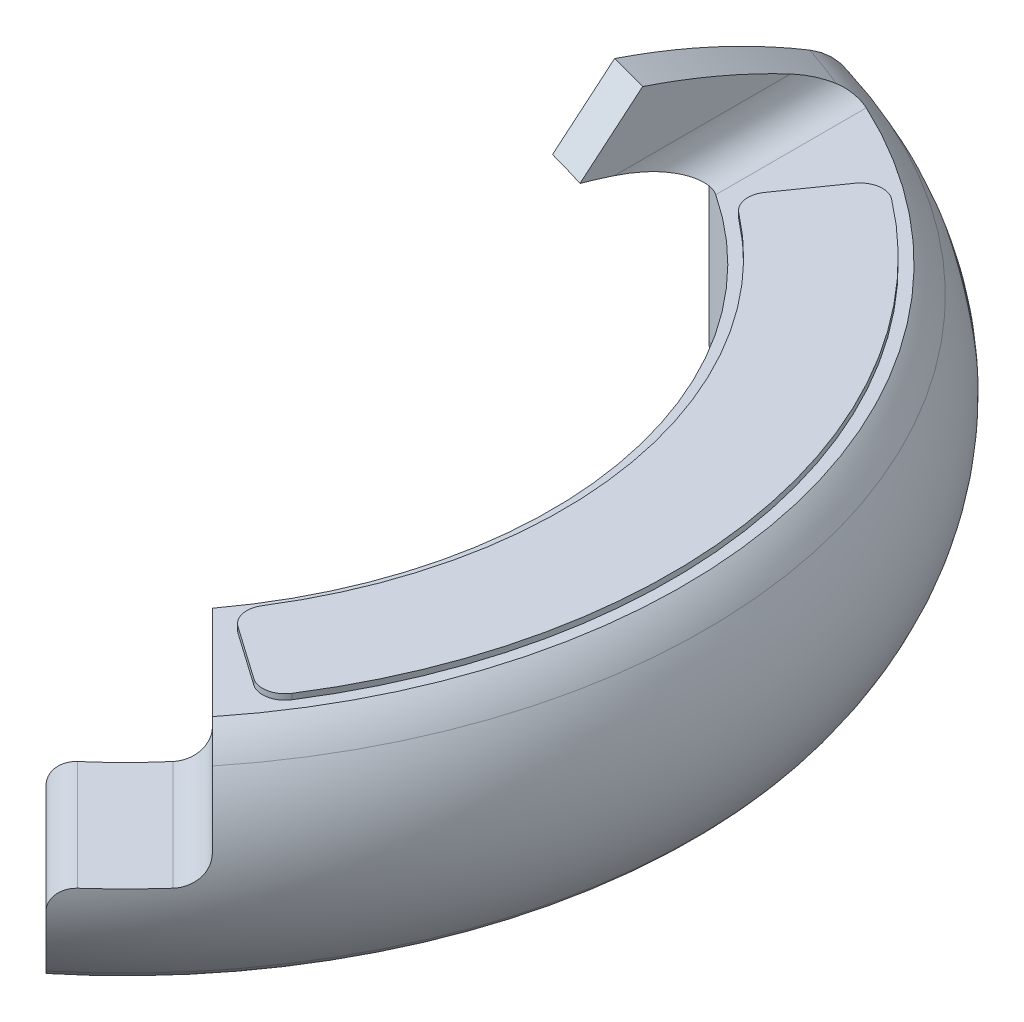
SolidWorks part; units mm, degrees
ref_plane "Спереди" through (0, 0, 0) normal (0, 0, 1) x (1, 0, 0)
ref_plane "Сверху" through (0, 0, 0) normal (0, 1, 0) x (1, 0, 0)
ref_plane "Справа" through (0, 0, 0) normal (1, 0, 0) x (0, 0, -1)
body saved out of another part "Заготовка-Дет1-1"
sketch "Эскиз1" plane through (150, 0, 0) normal (-1, 0, 0) x (0, 0, 1)
  line L0 (0, 308.0281) -> (0, -93.3009) construction
  line L1 (-575.822, 0) -> (432.2301, 0) construction
  circle A0 centre (-440, 100) radius 25
  dimension "D1" = 50
  dimension "D2" = 440
  dimension "D3" = 100
extrude "Вырез-Вытянуть1" cut sketch "Эскиз1" against normal blind 40
sketch "Эскиз2" plane through (190, 0, 0) normal (-1, 0, 0) x (0, 0, 1)
  line L0 (0, 355.3228) -> (0, -64.9241) construction
  line L1 (-440, 131.8407) -> (-440, 59.3746) construction
  line L3 (-440, 111.547) -> (-450, 105.7735)
  line L4 (-450, 105.7735) -> (-450, 94.2265)
  line L5 (-450, 94.2265) -> (-440, 88.453)
  line L6 (-440, 88.453) -> (-430, 94.2265)
  line L7 (-430, 94.2265) -> (-430, 105.7735)
  line L8 (-430, 105.7735) -> (-440, 111.547)
  circle A0 centre (-440, 100) radius 10 construction
  dimension "D1" = 20
extrude "Вырез-Вытянуть2" cut sketch "Эскиз2" against normal blind 40
ref_plane "Плоскость1" through (550, 0, 0) normal (1, 0, 0) x (0, 0, -1)
sketch "Эскиз3" plane through (550, 0, 0) normal (1, 0, 0) x (0, 0, -1)
  line L0 (0, 298.3906) -> (0, -137.0987) construction
  circle A0 centre (440, 100) radius 45
  circle A1 centre (440, 100) radius 50
  dimension "D1" = 90
  dimension "D2" = 100
extrude "Вырез-Вытянуть3" cut sketch "Эскиз3" against normal offset from surface (319.0126 mm away) 1
